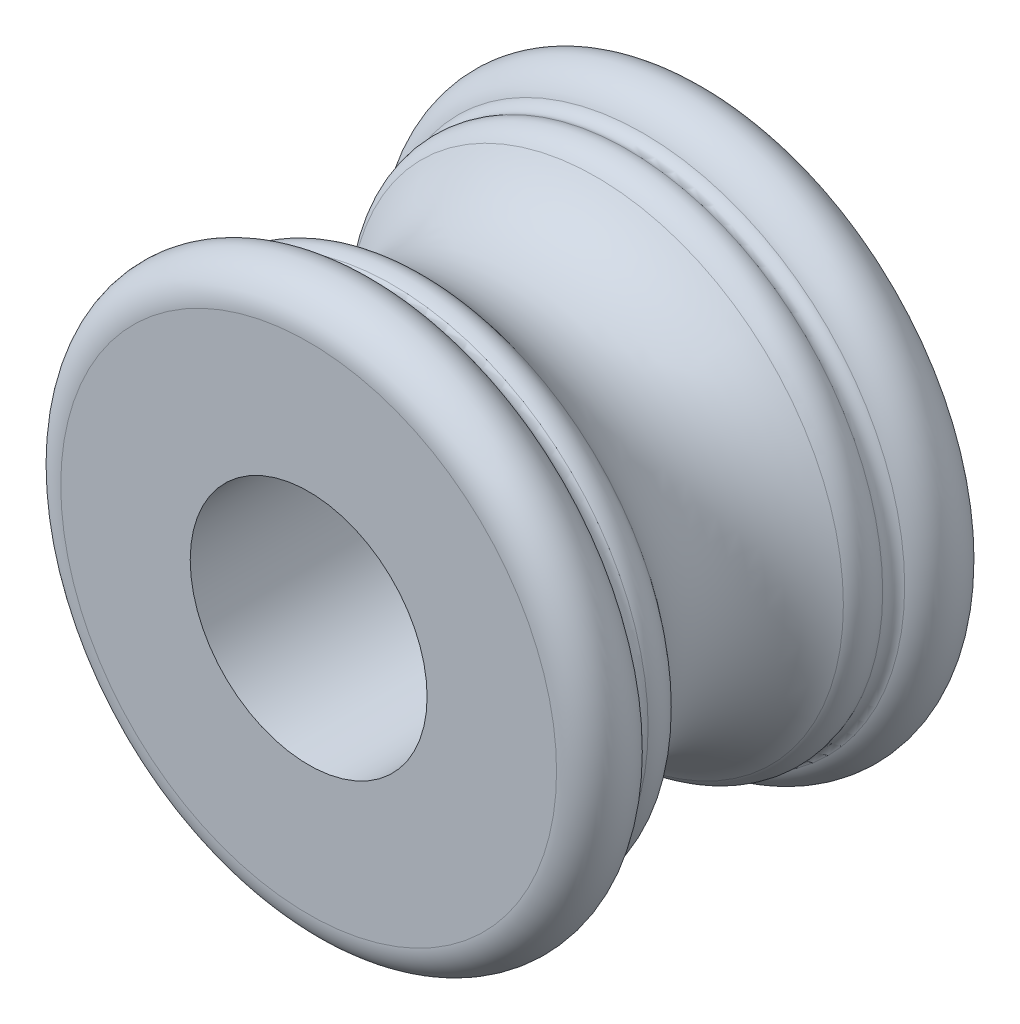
SolidWorks part; units mm, degrees
ref_plane "Спереди" through (0, 0, 0) normal (0, 0, 1) x (1, 0, 0)
ref_plane "Сверху" through (0, 0, 0) normal (0, 1, 0) x (1, 0, 0)
ref_plane "Справа" through (0, 0, 0) normal (1, 0, 0) x (0, 0, -1)
sketch "Эскиз1" plane through (0, 0, 0) normal (1, 0, 0) x (0, 0, -1)
  line L0 (-7.0792, 0) -> (17, 0) construction
  line L1 (-7.0792, 11.965) -> (17, 11.965) construction
  line L2 (0, 11.965) -> (0, 0) construction
  line L3 (17, 11.965) -> (17, 0) construction
  line L4 (0, 8.575) -> (17, 8.575) construction
  line L5 (8.5, 8.575) -> (8.5, 11.965) construction
  line L6 (0, 9.8) -> (17, 9.8) construction
  line L7 (0, 10.465) -> (0, 5)
  line L8 (17, 10.465) -> (17, 5)
  line L9 (0, 5) -> (17, 5)
  arc A0 (2.8835, 11.0447) -> (0, 10.465) centre (1.5, 10.465) ccw
  arc A1 (17, 10.465) -> (14.1165, 11.0447) centre (15.5, 10.465) ccw
  arc A2 (4.8582, 10.4316) -> (12.1418, 10.4316) centre (8.5, 13.075) ccw
  arc A3 (4.8582, 10.4316) -> (3.5488, 10.7815) centre (3.988, 9.8) ccw
  arc A4 (12.1418, 10.4316) -> (13.4512, 10.7815) centre (13.012, 9.8) cw
  arc A5 (14.1165, 11.0447) -> (13.4512, 10.7815) centre (13.6554, 11.2379) cw
  arc A6 (3.5488, 10.7815) -> (2.8835, 11.0447) centre (3.3446, 11.2379) cw
  dimension "D4" = 9
  dimension "D5" = 3
  dimension "D7" = 5
  dimension "D8" = 0.5
  dimension "D1" = 11.965
  dimension "D2" = 17
  dimension "D3" = 8.575
  dimension "D6" = 9.8
revolve "Повернуть1" add sketch "Эскиз1" angle 360 about L0
